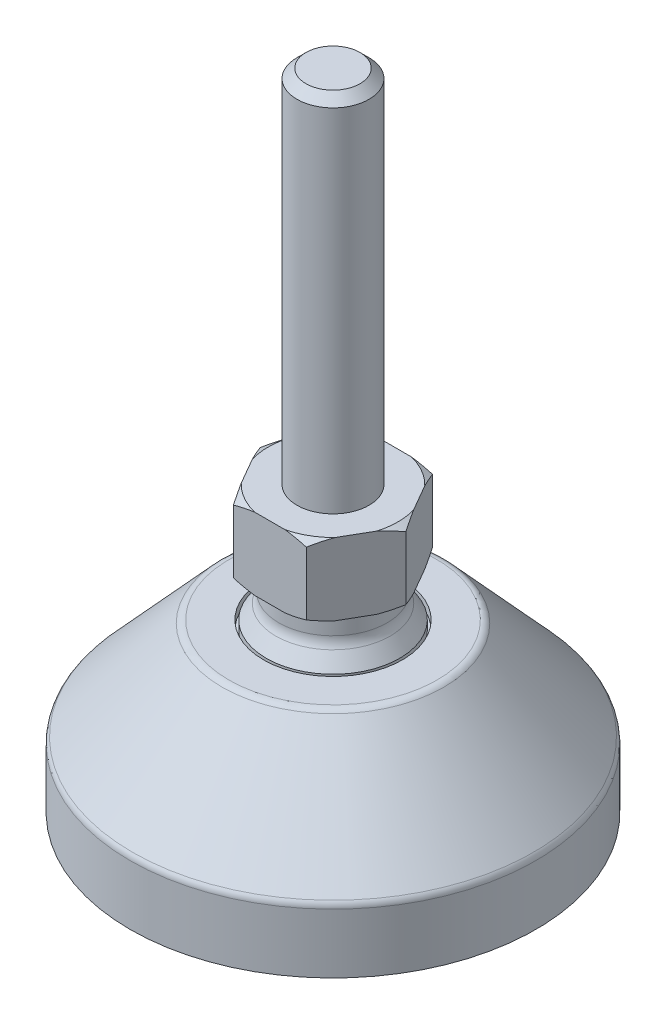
SolidWorks part; units mm, degrees
ref_plane "Front Plane" through (0, 0, 0) normal (0, 0, 1) x (1, 0, 0)
ref_plane "Top Plane" through (0, 0, 0) normal (0, 1, 0) x (1, 0, 0)
ref_plane "Right Plane" through (0, 0, 0) normal (1, 0, 0) x (0, 0, -1)
sketch "Sketch1" plane through (0, 0, 0) normal (0, 1, 0) x (1, 0, 0)
  circle A1 centre (0, 0) radius 18
  dimension "D1" = 36
extrude "Boss-Extrude1" add sketch "Sketch1" along normal blind 2.5
sketch "Sketch2" plane through (0, 2.5, 0) normal (0, 1, 0) x (1, 0, 0)
  circle A0 centre (0, 0) radius 22.5
  dimension "D1" = 45
extrude "Boss-Extrude2" add sketch "Sketch2" along normal blind 7
ref_plane "Plane1" through (0, 21, 0) normal (0, 1, 0) x (1, 0, 0)
sketch "Sketch3" plane through (0, 21, 0) normal (0, 1, 0) x (1, 0, 0)
  circle A0 centre (0, 0) radius 12
  dimension "D1" = 24
loft "Loft1" add profiles "Sketch3"
ref_plane "Plane2" through (0, 23.1, 0) normal (0, 1, 0) x (1, 0, 0)
sketch "Sketch4" plane through (0, 21, 0) normal (0, 1, 0) x (1, 0, 0)
  circle A0 centre (0, 0) radius 7.4
  dimension "D1" = 14.8
sketch "Sketch5" plane through (0, 23.1, 0) normal (0, 1, 0) x (1, 0, 0)
  circle A0 centre (0, 0) radius 6
  dimension "D1" = 12
loft "Loft2" add profiles "Sketch4", "Sketch5"
sketch "Sketch11" plane through (0, 21, 0) normal (0, 1, 0) x (1, 0, 0)
  circle A0 centre (0, 0) radius 7.4 construction
  circle A1 centre (0, 0) radius 7.4
  circle A2 centre (0, 0) radius 7.7
  dimension "D1" = 0.3
extrude "Cut-Extrude1" cut sketch "Sketch11" against normal blind 1
sketch "Sketch6" plane through (0, 23.1, 0) normal (0, 1, 0) x (1, 0, 0)
  circle A1 centre (0, 0) radius 6
  circle A2 centre (0, 0) radius 6
  dimension "D1" = 0
extrude "Boss-Extrude3" add sketch "Sketch6" along normal blind 2.9
sketch "Sketch7" plane through (0, 26, 0) normal (0, 1, 0) x (1, 0, 0)
  circle A0 centre (0, 0) radius 4
  dimension "D1" = 8
extrude "Boss-Extrude4" add sketch "Sketch7" along normal blind 48
sketch "Sketch8" plane through (0, 26, 0) normal (0, 1, 0) x (1, 0, 0)
  line L1 (8.0829, 0) -> (4.0415, 7)
  line L2 (4.0415, 7) -> (-4.0415, 7)
  line L3 (-4.0415, 7) -> (-8.0829, 0)
  line L4 (-8.0829, 0) -> (-4.0415, -7)
  line L5 (-4.0415, -7) -> (4.0415, -7)
  line L6 (4.0415, -7) -> (8.0829, 0)
  circle A0 centre (0, 0) radius 7 construction
  circle A1 centre (0, 0) radius 4 construction
  circle A2 centre (0, 0) radius 4
  dimension "D1" = 14
extrude "Boss-Extrude5" add sketch "Sketch8" along normal blind 8
sketch "Sketch9" plane through (0, 0, 0) normal (0, 0, 1) x (1, 0, 0)
  line L0 (-7.2, 34) -> (-8.0829, 33.5)
  line L1 (-8.0829, 34) -> (-4.0415, 34) construction
  line L2 (-8.0829, 34) -> (-8.0829, 26) construction
  line L3 (-8.0829, 26.5) -> (-7.2, 26)
  line L4 (-8.0829, 26) -> (-4.0415, 26) construction
  line L5 (-7.2, 34) -> (-7.2, 26) construction
  line L6 (0, -12.7051) -> (0, 12.7051) construction
  line L7 (-8.0829, 26.5) -> (-8.0829, 26)
  line L8 (-8.0829, 26) -> (-7.2, 26)
  line L9 (-7.2, 34) -> (-8.0829, 34)
  line L10 (-8.0829, 34) -> (-8.0829, 33.5)
  dimension "D1" = 7.2
  dimension "D2" = 0.5
  dimension "D3" = 0.5
revolve "Cut-Revolve1" cut sketch "Sketch9" angle 360 about axis through (0, 74, 0) along (0, -1, 0)
chamfer "Chamfer1" distance 1 angle 45 1 edges at (0, 74, 4)
sketch "Sketch10" plane through (0, 0, 0) normal (0, -1, 0) x (1, 0, 0)
  line L0 (3, 6) -> (12.3718, 6)
  line L2 (-3, -13.4187) -> (-3, -6)
  line L4 (3, -13.4187) -> (3, -6)
  line L5 (-3, -13.4187) -> (3, 13.4187) construction
  line L6 (-3, 13.4187) -> (3, -13.4187) construction
  line L7 (-12.3718, -6) -> (-3, -6)
  line L9 (-12.3718, 6) -> (-3, 6)
  line L11 (-12.3718, -6) -> (12.3718, 6) construction
  line L12 (-12.3718, 6) -> (12.3718, -6) construction
  line L13 (3, 6) -> (3, 13.4187)
  line L14 (-3, 6) -> (-3, 13.4187)
  line L15 (3, -6) -> (12.3718, -6)
  arc A0 (-12.3718, -6) -> (-3, -13.4187) centre (0, 0) ccw
  arc A1 (12.3718, 6) -> (3, 13.4187) centre (0, 0) ccw
  arc A2 (-3, 13.4187) -> (-12.3718, 6) centre (0, 0) ccw
  arc A3 (3, -13.4187) -> (12.3718, -6) centre (0, 0) ccw
  dimension "D1" = 27.5
  dimension "D2" = 6
  dimension "D3" = 12
extrude "Boss-Extrude6" add sketch "Sketch10" along normal blind 1
fillet "Fillet1" radius 1 2 edges at (0, 9.5, 22.5) (0, 21, 12)
fillet "Fillet2" radius 2 1 edges at (0, 23.1, 6)
